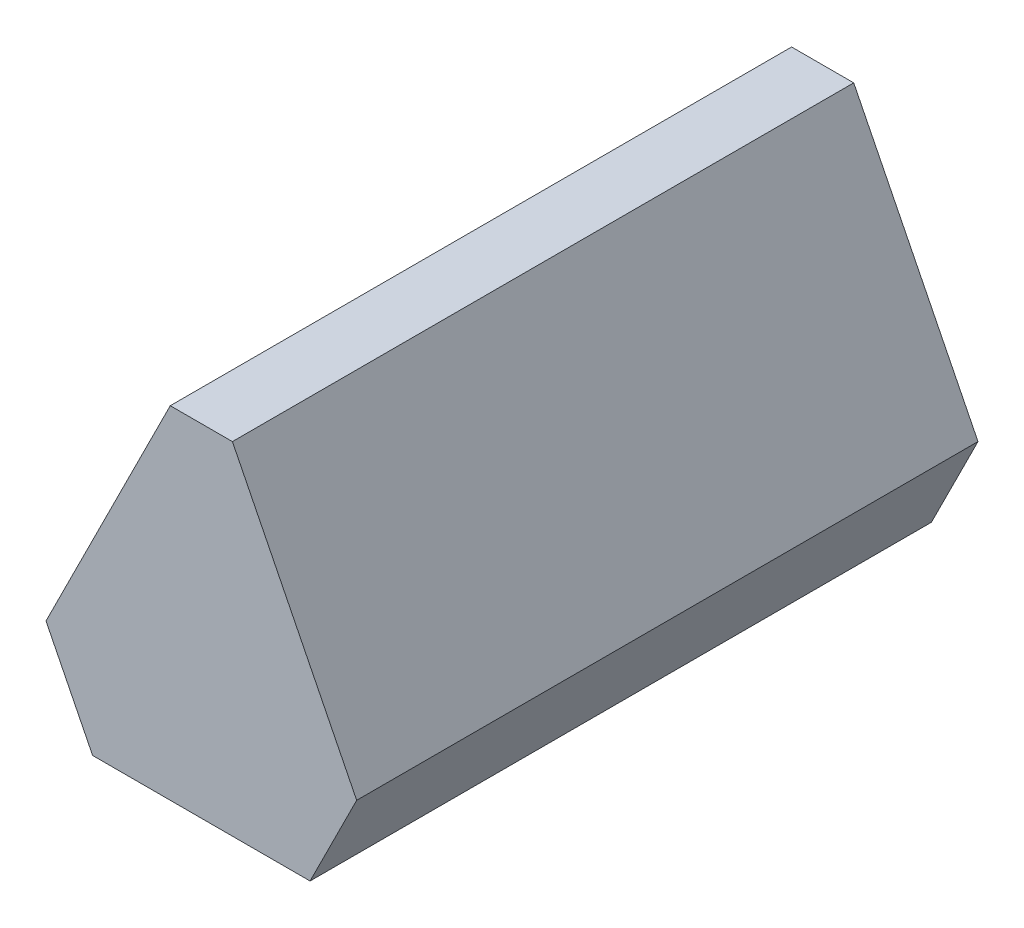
SolidWorks part; units mm, degrees
ref_plane "Front Plane" through (0, 0, 0) normal (0, 0, 1) x (1, 0, 0)
ref_plane "Top Plane" through (0, 0, 0) normal (0, 1, 0) x (1, 0, 0)
ref_plane "Right Plane" through (0, 0, 0) normal (1, 0, 0) x (0, 0, -1)
sketch "Sketch1" plane through (0, 0, 0) normal (0, 0, 1) x (1, 0, 0)
  line L0 (0, 0) -> (0, 275) construction
  line L1 (87.5, 0) -> (-87.5, 0)
  line L2 (-87.5, 0) -> (-125, 75)
  line L3 (-125, 75) -> (-25, 275)
  line L4 (-25, 275) -> (25, 275)
  line L5 (125, 75) -> (25, 275)
  line L6 (87.5, 0) -> (125, 75)
  dimension "D1" = 275
  dimension "D2" = 50
  dimension "D3" = 175
  dimension "D4" = 250
  dimension "D5" = 75
extrude "Boss-Extrude1" add sketch "Sketch1" along normal mid plane 500
